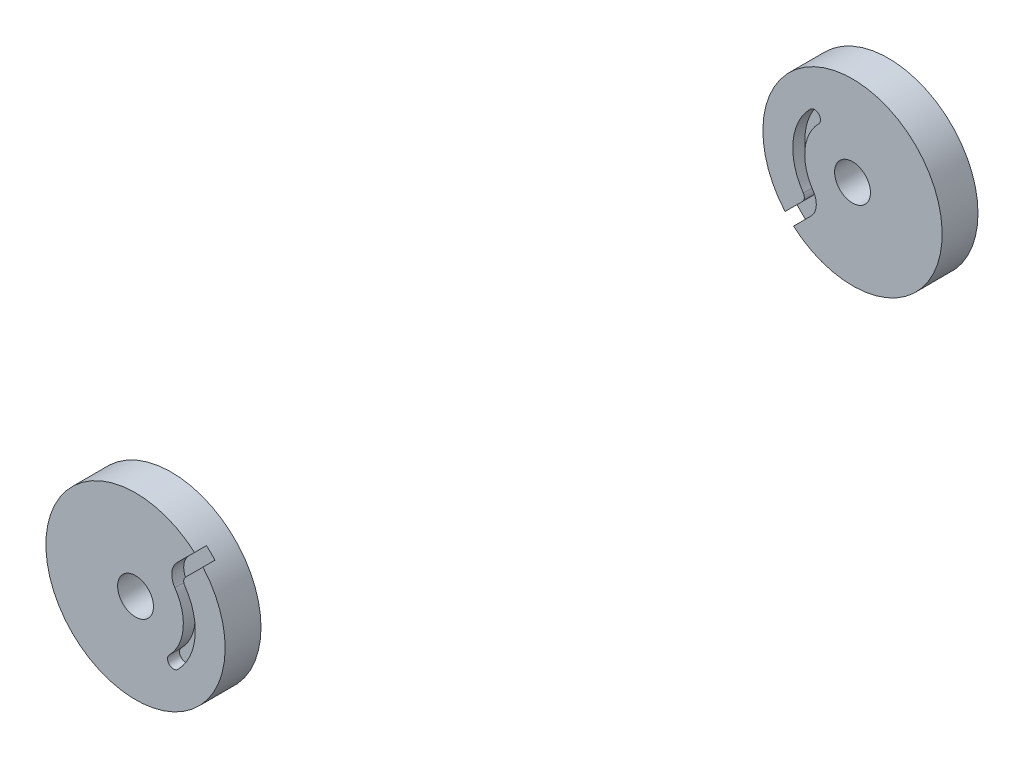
SolidWorks part; units mm, degrees
ref_plane "Plan de face" through (0, 0, 0) normal (0, 0, 1) x (1, 0, 0)
ref_plane "Plan de dessus" through (0, 0, 0) normal (0, 1, 0) x (1, 0, 0)
ref_plane "Plan de droite" through (0, 0, 0) normal (1, 0, 0) x (0, 0, -1)
sketch "Esquisse1" plane through (0, 0, 0) normal (0, 0, 1) x (1, 0, 0)
  line L0 (-31.8773, 0) -> (31.8773, 0) construction
  line L2 (0, 31.8773) -> (0, -30.6288) construction
  line L3 (0, 0) -> (120, 120) construction
  line L5 (0, 0) -> (120, 0) construction
  line L6 (0, 0) -> (0, 120) construction
  line L7 (0, 120) -> (120, 120) construction
  line L8 (120, 0) -> (120, 120) construction
  circle A0 centre (0, 0) radius 3
  circle A1 centre (0, 0) radius 15
  circle A2 centre (120, 120) radius 3
  circle A3 centre (120, 120) radius 15
extrude "Extrusion1" add sketch "Esquisse1" along normal blind 6
sketch "Esquisse2" plane through (0, 0, 6) normal (0, 0, 1) x (1, 0, 0)
  line L0 (0, 0) -> (6.0674, 6.0674) construction
  line L1 (0, 0) -> (120, 0) construction
  line L2 (0, 0) -> (0, 120) construction
  line L3 (0, 120) -> (120, 120) construction
  line L4 (120, 0) -> (120, 120) construction
  line L5 (0, 0) -> (19.3093, -19.3093) construction
  line L6 (-20.4098, -18.9956) -> (111.6444, 113.0586) construction
  line L7 (120, 120) -> (97.4398, 142.5602) construction
  line L8 (135.8493, 134.4351) -> (8.3556, 6.9414) construction
  line L9 (6.9414, 8.3556) -> (11.169, 12.5832)
  line L10 (11.169, 12.5832) -> (12.5832, 11.169)
  line L11 (12.5832, 11.169) -> (8.3556, 6.9414)
  line L12 (113.9326, 113.9326) -> (120, 120) construction
  line L13 (108.7698, 107.3556) -> (107.3556, 108.7698)
  line L14 (107.3556, 108.7698) -> (111.6444, 113.0586)
  line L15 (113.0586, 111.6444) -> (108.7698, 107.3556)
  line L16 (113.6444, 115.0586) -> (134.5317, 135.9459) construction
  line L17 (7.6485, 7.6485) -> (112.3515, 112.3515) construction
  line L18 (6.3556, 4.9414) -> (-14.8423, -16.2565) construction
  arc A0 (5.6569, -5.6569) -> (6.5911, 4.534) centre (0, 0) ccw
  arc A1 (7.0711, -7.0711) -> (8.2389, 5.6676) centre (0, 0) ccw
  arc A2 (114.3431, 125.6569) -> (113.4089, 115.466) centre (120, 120) ccw
  arc A3 (112.9289, 127.0711) -> (111.7611, 114.3324) centre (120, 120) ccw
  arc A4 (113.636, 126.364) -> (112.585, 114.8992) centre (120, 120) ccw construction
  arc A5 (6.364, -6.364) -> (7.415, 5.1008) centre (0, 0) ccw construction
  arc A6 (5.6569, -5.6569) -> (7.0711, -7.0711) centre (6.364, -6.364) ccw
  arc A7 (8.3556, 6.9414) -> (8.2389, 5.6676) centre (9.0627, 6.2343) ccw
  arc A8 (-7.0317, -5.6174) -> (-5.6174, -7.0317) centre (0, 0) ccw construction
  arc A9 (6.9414, 8.3556) -> (6.5911, 4.534) centre (9.0627, 6.2343) ccw
  arc A10 (7.6485, 7.6485) -> (7.415, 5.1008) centre (9.0627, 6.2343) ccw construction
  arc A11 (112.9289, 127.0711) -> (114.3431, 125.6569) centre (113.636, 126.364) cw
  arc A12 (111.7611, 114.3324) -> (111.6444, 113.0586) centre (110.9373, 113.7657) cw
  arc A13 (113.0586, 111.6444) -> (113.4089, 115.466) centre (110.9373, 113.7657) ccw
  arc A14 (112.3515, 112.3515) -> (112.585, 114.8992) centre (110.9373, 113.7657) ccw construction
  point P16 (112.2573, 113.6715)
  point P20 (7.7427, 6.3285)
  dimension "D2" = 1
  dimension "D5" = 1
  dimension "D6" = 1
  dimension "D1" = 90
  dimension "D3" = 1
  dimension "D4" = 90
extrude "Enlèv. mat.-Extru.1" cut sketch "Esquisse2" against normal blind 2
ref_plane "Plan1" through (0, 0, 5) normal (0, 0, 1) x (1, 0, 0)
sketch "Esquisse4" plane through (0, 0, 5) normal (0, 0, 1) x (1, 0, 0)
  line L0 (0, 0) -> (122.1213, 122.1213)
  circle A0 centre (120, 120) radius 3 construction
